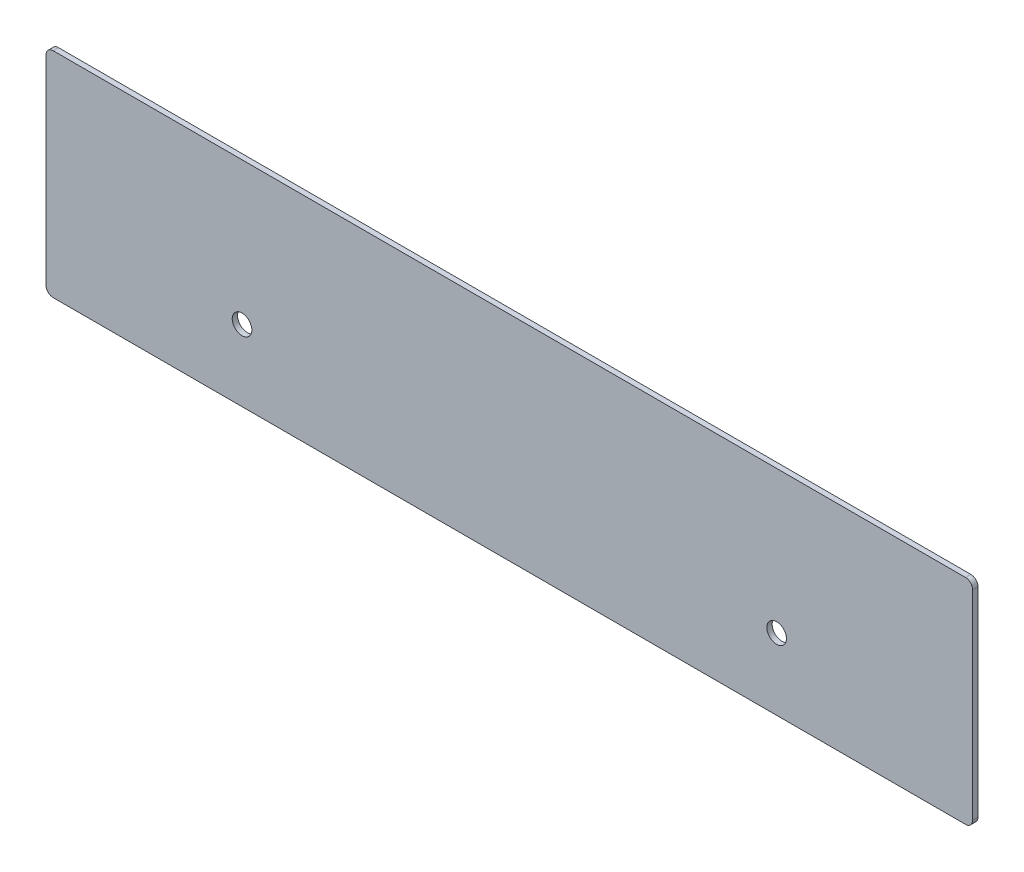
SolidWorks part; units mm, degrees
ref_plane "Ebene vorne" through (0, 0, 0) normal (0, 0, 1) x (1, 0, 0)
ref_plane "Ebene oben" through (0, 0, 0) normal (0, 1, 0) x (1, 0, 0)
ref_plane "Ebene rechts" through (0, 0, 0) normal (1, 0, 0) x (0, 0, -1)
sketch "Skizze1" plane through (0, 0, 0) normal (0, 0, 1) x (1, 0, 0)
  line L1 (-130, -30) -> (130, -30)
  line L2 (-130, -30) -> (-130, 30)
  line L3 (-130, 30) -> (130, 30)
  line L4 (130, -30) -> (130, 30)
  line L5 (-130, -30) -> (130, 30) construction
  line L6 (-130, 30) -> (130, -30) construction
  point P0 (0, 0)
  dimension "D1" = 60
  dimension "D2" = 260
extrude "Aufsatz-Linear austragen1" add sketch "Skizze1" along normal blind 1.5
sketch "Skizze2" plane through (0, 0, 1.5) normal (0, 0, 1) x (1, 0, 0)
  line L0 (0, 0) -> (0, -10) construction
  line L1 (0, -53.599) -> (0, 53.599) construction
  line L2 (0, -10) -> (-75, -10) construction
  line L3 (0, -10) -> (75, -10) construction
  line L4 (-130, -30) -> (130, -30) construction
  circle A0 centre (-75, -10) radius 2.75
  circle A1 centre (75, -10) radius 2.75
  dimension "D3" = 5.5
  dimension "D4" = 5.5
  dimension "D1" = 20
  dimension "D2" = 150
extrude "Schnitt-Linear austragen1" cut sketch "Skizze2" against normal through all
fillet "Verrundung1" radius 2 4 edges at (-130, -30, 0.75) (130, -30, 0.75) (130, 30, 0.75) (-130, 30, 0.75)
